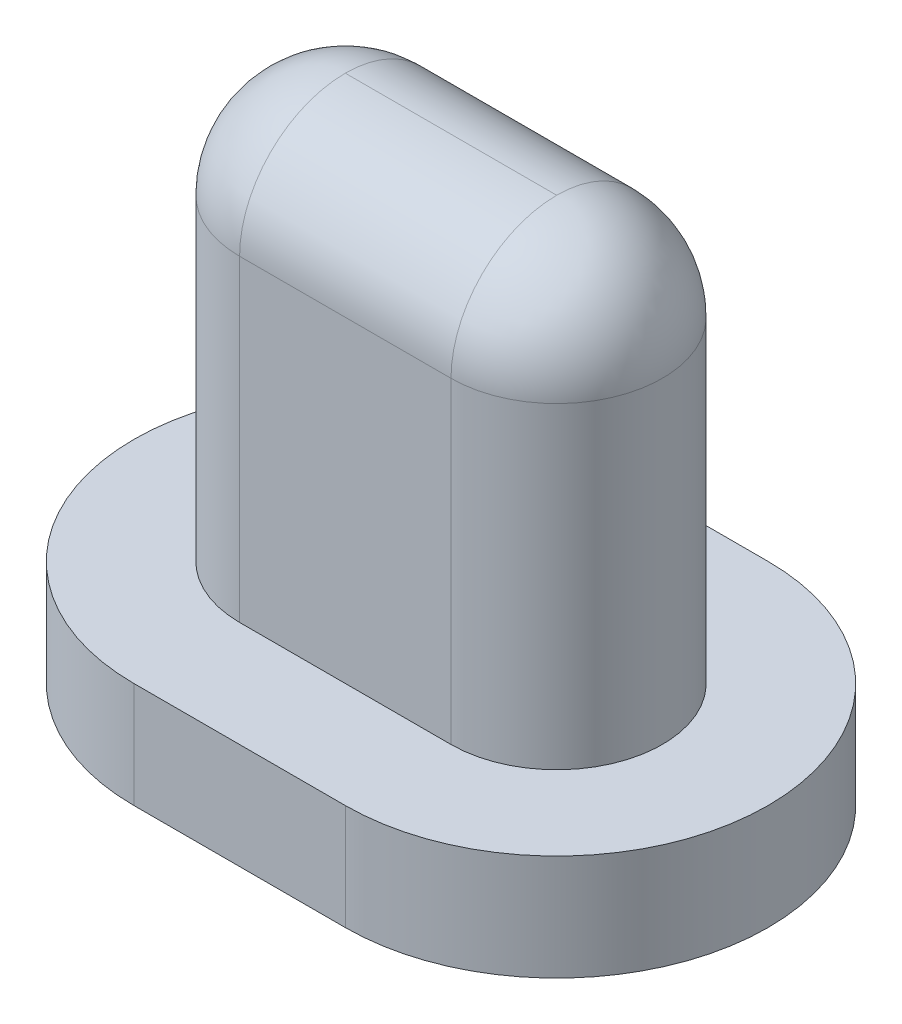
SolidWorks part; units mm, degrees
ref_plane "Front Plane" through (0, 0, 0) normal (0, 0, 1) x (1, 0, 0)
ref_plane "Top Plane" through (0, 0, 0) normal (0, 1, 0) x (1, 0, 0)
ref_plane "Right Plane" through (0, 0, 0) normal (1, 0, 0) x (0, 0, -1)
sketch "Sketch1" plane through (0, 0, 0) normal (0, 1, 0) x (1, 0, 0)
  line L0 (0, 0) -> (2, 0) construction
  line L1 (0, 1) -> (2, 1)
  line L2 (0, -1) -> (2, -1)
  arc A0 (0, 1) -> (0, -1) centre (0, 0) ccw
  arc A1 (2, -1) -> (2, 1) centre (2, 0) ccw
  point P3 (1, 0)
  dimension "D2" = 1
  dimension "D1" = 2
extrude "Boss-Extrude1" add sketch "Sketch1" along normal blind 4
fillet "Fillet1" radius 1 4 edges at (1, 4, -1) (-1, 4, 0) (3, 4, 0) (1, 4, 1)
sketch "Sketch2" plane through (0, 0, 0) normal (0, -1, 0) x (1, 0, 0)
  line L4 (0, -2) -> (2, -2)
  line L5 (2, 2) -> (0, 2)
  line L6 (0, -2) -> (2, -2)
  line L7 (2, 2) -> (0, 2)
  arc A4 (0, 2) -> (0, -2) centre (0, 0) ccw
  arc A5 (2, -2) -> (2, 2) centre (2, 0) ccw
  arc A6 (0, 2) -> (0, -2) centre (0, 0) ccw
  arc A7 (2, -2) -> (2, 2) centre (2, 0) ccw
  dimension "D1" = 1
extrude "Boss-Extrude2" add sketch "Sketch2" along normal blind 1
